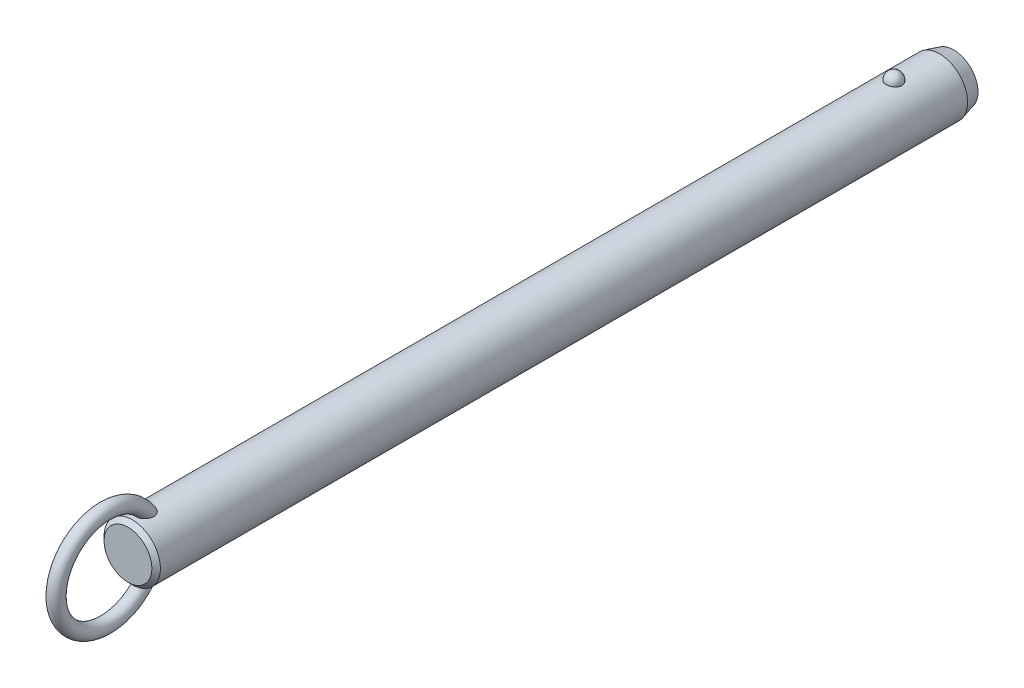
SolidWorks part; units mm, degrees
ref_plane "Front Plane" through (0, 0, 0) normal (0, 0, 1) x (1, 0, 0)
ref_plane "Top Plane" through (0, 0, 0) normal (0, 1, 0) x (1, 0, 0)
ref_plane "Right Plane" through (0, 0, 0) normal (1, 0, 0) x (0, 0, -1)
sketch "Sketch2" plane through (0, 0, 0) normal (0, 0, 1) x (1, 0, 0)
  circle A0 centre (0, 0) radius 7.9
  point P3 (0, 7.9)
  dimension "D1" = 15.8
extrude "Boss-Extrude1" add sketch "Sketch2" along normal blind 203.2
sketch "Sketch3" plane through (0, 0, 0) normal (0, 0, -1) x (-1, 0, 0)
  circle A0 centre (0, 0) radius 7.9
  dimension "D1" = 15.8
extrude "Boss-Extrude2" add sketch "Sketch3" along normal blind 19
chamfer "Chamfer1" distance 4 angle 15 1 edges at (-7.9, 0, -19)
sketch "Sketch12" plane through (0, 0, 0) normal (1, 0, 0) x (0, 0, -1)
  line L0 (-203.2, 7.9) -> (-203.2, -7.9) construction
  point P0 (-203.2, 0)
sketch "Sketch13" plane through (0, 0, 0) normal (1, 0, 0) x (0, 0, -1)
  circle A0 centre (-219.05, 0) radius 15.85
  point P2 (-203.2, 0)
  dimension "D1" = 31.7
sketch "Sketch14" plane through (0, 0, 0) normal (0, 1, 0) x (1, 0, 0)
  circle A0 centre (0, -205.2) radius 2
  point P2 (0, -203.2)
  dimension "D1" = 4
sweep "Sweep1" add profiles "Sketch14" path "Sketch13"
sketch "Sketch15" plane through (0, 0, 203.2) normal (0, 0, 1) x (1, 0, 0)
  circle A0 centre (0, 0) radius 7.9
  dimension "D1" = 15.8
extrude "Boss-Extrude3" add sketch "Sketch15" along normal blind 9.52
chamfer "Chamfer2" distance 1.2 angle 45 1 edges at (7.9, 0, 212.72)
sketch "Sketch18" plane through (0, 0, 0) normal (1, 0, 0) x (0, 0, -1)
  line L0 (15, 7.9) -> (-205.3091, 7.9) construction
  line L1 (2.2, 10.1) -> (2.2, 5.7)
  line L2 (-205.3091, -7.9) -> (15, -7.9) construction
  arc A0 (2.2, 10.1) -> (2.2, 5.7) centre (2.2, 7.9) ccw
  point P4 (0, 7.9)
  dimension "D1" = 18
revolve "Revolve1" add sketch "Sketch18" angle 360 about L1
